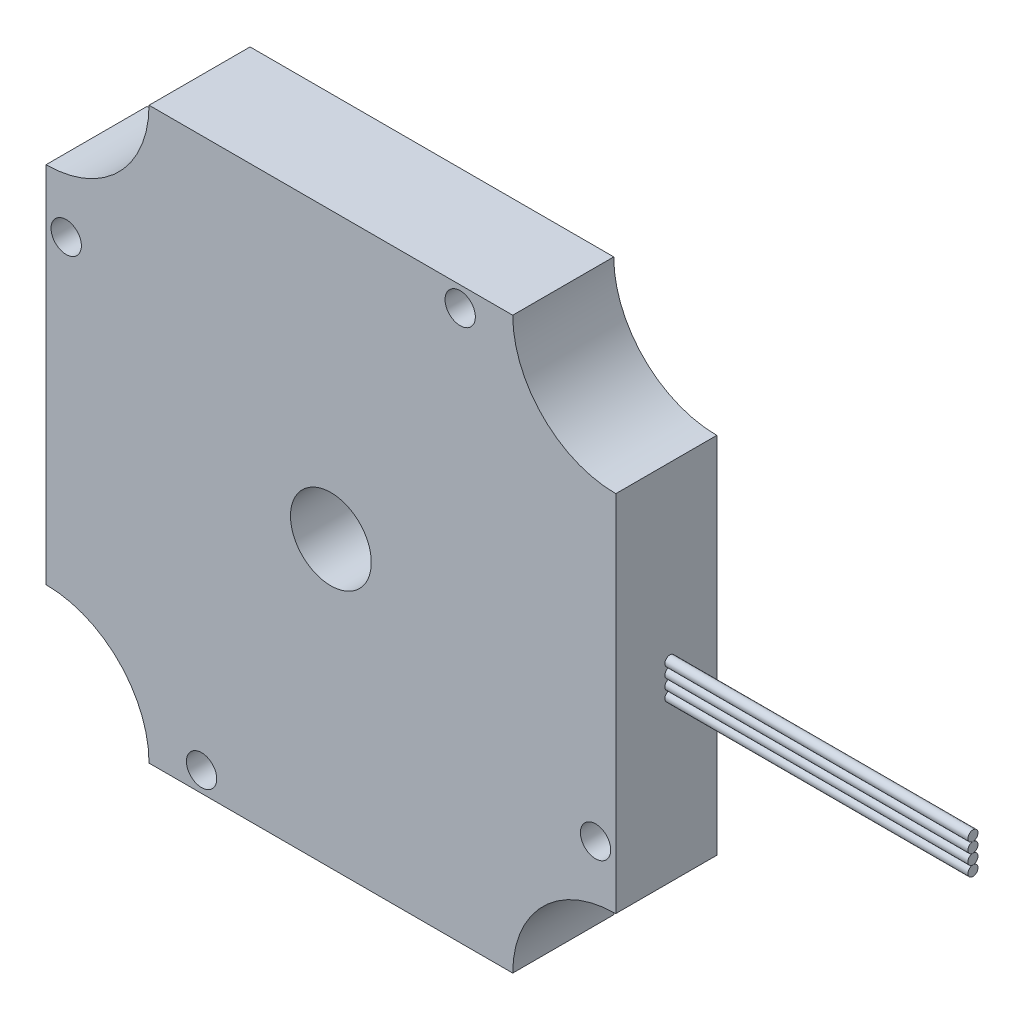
SolidWorks part; units mm, degrees
ref_plane "前视" through (0, 0, 0) normal (0, 0, 1) x (1, 0, 0)
ref_plane "上视" through (0, 0, 0) normal (0, 1, 0) x (1, 0, 0)
ref_plane "右视" through (0, 0, 0) normal (1, 0, 0) x (0, 0, -1)
sketch "草图1" plane through (0, 0, 0) normal (0, 0, 1) x (1, 0, 0)
  line L0 (-18, -28.2) -> (18, -28.2)
  line L2 (28.2, -18) -> (28.2, 18)
  line L3 (18, 28.2) -> (-18, 28.2)
  line L4 (-28.2, -18) -> (-28.2, 18)
  line L5 (28.2, -28.2) -> (-28.2, 28.2) construction
  line L6 (28.2, 28.2) -> (-28.2, -28.2) construction
  line L11 (18, -28.2) -> (-18, 28.2) construction
  line L12 (18, 28.2) -> (-18, -28.2) construction
  line L18 (28.2, -18) -> (-28.2, 18) construction
  line L19 (28.2, 18) -> (-28.2, -18) construction
  arc A0 (-28.2, 18) -> (-18, 28.2) centre (-28.2, 28.2) ccw
  arc A1 (18, 28.2) -> (28.2, 18) centre (28.2, 28.2) ccw
  arc A2 (28.2, -18) -> (18, -28.2) centre (28.2, -28.2) ccw
  arc A3 (-18, -28.2) -> (-28.2, -18) centre (-28.2, -28.2) ccw
  point P0 (0, 0)
  point P6 (0, 0)
  point P11 (0, 0)
  dimension "D1" = 56.4
  dimension "D2" = 56.4
  dimension "D3" = 36
  dimension "D4" = 36
extrude "凸台-拉伸1" add sketch "草图1" along normal blind 10
sketch "草图2" plane through (0, 0, 0) normal (0, 0, -1) x (-1, 0, 0)
  circle A0 centre (0, 0) radius 4
extrude "切除-拉伸1" cut sketch "草图2" against normal blind 10
sketch "草图3" plane through (28.2, 0, 0) normal (1, 0, 0) x (0, 0, -1)
  circle A0 centre (-4.6434, 0) radius 0.5
  circle A1 centre (-4.6434, 1) radius 0.5
  circle A2 centre (-4.6434, -1) radius 0.5
  circle A3 centre (-4.6434, -2) radius 0.5
extrude "凸台-拉伸2" add sketch "草图3" along normal blind 30 separate body contours A3 | A2 | A0 | A1
sketch "草图4" plane through (0, 0, 0) normal (0, 0, -1) x (-1, 0, 0)
  circle A0 centre (-12.8, 26.2) radius 1.5
extrude "切除-拉伸2" cut sketch "草图4" against normal blind 50
pattern_circular "阵列(圆周)1" count 4 over 360 about axis through (0, 0, 0) along (0, 0, 1) of "切除-拉伸2"
